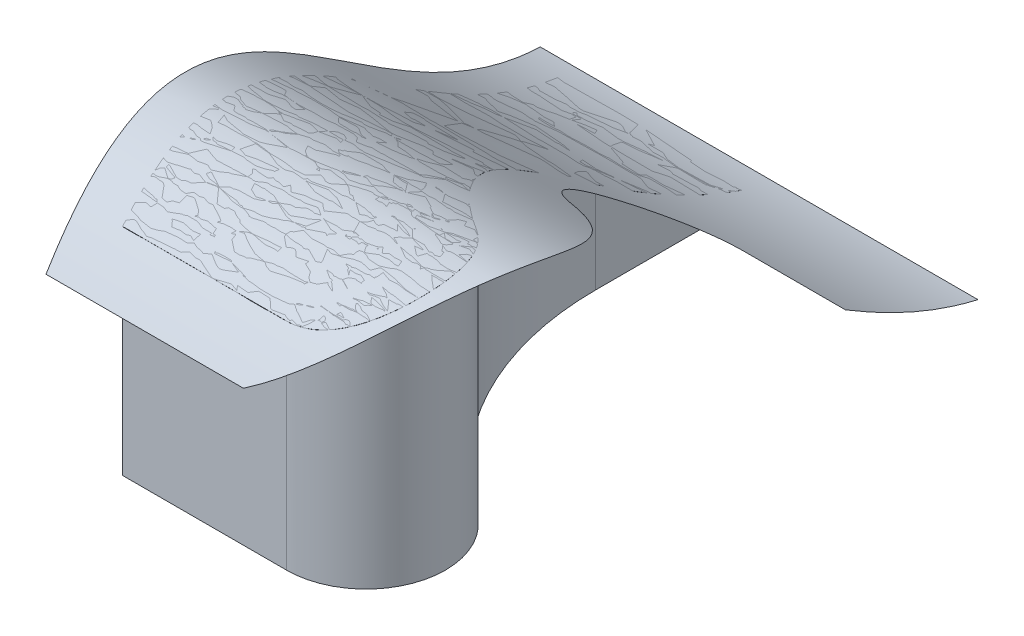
SolidWorks part; units mm, degrees
ref_plane "Front Plane" through (0, 0, 0) normal (0, 0, 1) x (1, 0, 0)
ref_plane "Top Plane" through (0, 0, 0) normal (0, 1, 0) x (1, 0, 0)
ref_plane "Right Plane" through (0, 0, 0) normal (1, 0, 0) x (0, 0, -1)
sketch "Sketch1" plane through (0, 0, 0) normal (1, 0, 0) x (0, 0, -1)
  spline S0 degree 3 poles (-50.2564, -4.6182) (-13.8908, 81.4125) (14.6119, -15.5554) (62.2093, 1.6299) knots 0 0 0 0 1 1 1 1
surface "Surface-Extrude1" sketch "Sketch1" parameters "D1"=101.6
ref_plane "Plane1" through (0, 96.52, 0) normal (0, 1, 0) x (1, 0, 0)
sketch "Sketch2" plane through (0, 96.52, 0) normal (0, 1, 0) x (1, 0, 0)
  line L0 (-22.6573, 42.4703) -> (32.1699, 42.4703)
  line L1 (32.1699, 42.4703) -> (32.1699, 25.8664)
  line L2 (32.1699, 25.8664) -> (19.5441, 25.8664)
  line L3 (17.4686, -34.8413) -> (-7.2642, -34.8413)
  line L4 (-7.2642, -34.8413) -> (-22.6573, 42.4703)
  arc A0 (19.5441, 25.8664) -> (16.085, 7.533) centre (19.5441, 16.3734) ccw
  arc A1 (16.085, 7.533) -> (17.4686, -34.8413) centre (7.6784, -13.9512) cw
surface "Surface-Trim1"
sketch "Sketch3" plane through (0, 0, 0) normal (0, 1, 0) x (1, 0, 0)
  line L0 (-17.4067, 39.3793) -> (-2.8132, -29.6965)
  line L1 (-2.8132, -29.6965) -> (17.7258, -29.6965)
  line L2 (6.688, 20.059) -> (6.688, 39.3793)
  line L3 (6.688, 39.3793) -> (-17.4067, 39.3793)
  arc A0 (17.7258, -29.6965) -> (23.347, -11.5357) centre (17.7258, -19.7462) ccw
  arc A1 (23.347, -11.5357) -> (6.688, 20.059) centre (44.978, 20.059) cw
extrude "Boss-Extrude2" add sketch "Sketch3" along normal blind 101.6
other "SurfaceCut1"
